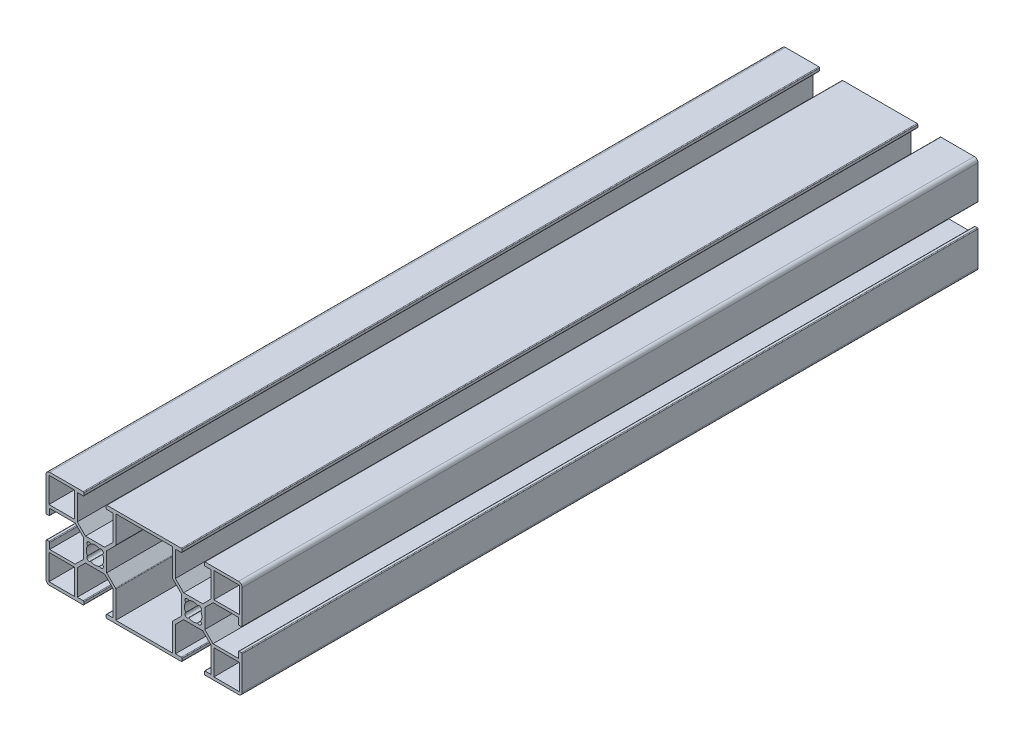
SolidWorks part; units mm, degrees
ref_plane "前视基准面" through (0, 0, 0) normal (0, 0, 1) x (1, 0, 0)
ref_plane "上视基准面" through (0, 0, 0) normal (0, 1, 0) x (1, 0, 0)
ref_plane "右视基准面" through (0, 0, 0) normal (1, 0, 0) x (0, 0, -1)
sketch "草图1" plane through (0, 0, 0) normal (0, 0, 1) x (1, 0, 0)
  line B0 (-60, 18.8) -> (-59.9697, 18.8)
  line B1 (8.45, -8.45) -> (18.8, -8.45)
  line B2 (18.8, -8.45) -> (18.8, -18.8)
  line B3 (18.8, -18.8) -> (8.45, -18.8)
  line B4 (8.45, -18.8) -> (8.45, -8.45)
  line B5 (18.8, 18.8) -> (18.8, 8.45)
  line B6 (18.8, 8.45) -> (8.45, 8.45)
  line B7 (8.45, 8.45) -> (8.45, 18.8)
  line B8 (8.45, 18.8) -> (18.8, 18.8)
  line B9 (-58.8, -18.8) -> (-48.45, -18.8)
  line B10 (-48.45, -18.8) -> (-48.45, -8.45)
  line B11 (-48.45, -8.45) -> (-58.8, -8.45)
  line B12 (-58.8, -8.45) -> (-58.8, -18.8)
  line B13 (-58.8, 8.45) -> (-58.8, 18.8)
  line B14 (-58.8, 18.8) -> (-48.45, 18.8)
  line B15 (-48.45, 18.8) -> (-48.45, 8.45)
  line B16 (-48.45, 8.45) -> (-58.8, 8.45)
  line B17 (-41.7918, 3.0646) -> (-41.8385, 3.1113)
  line B18 (-43.1113, 1.8385) -> (-43.0646, 1.7918)
  line B19 (-43.0646, -1.7918) -> (-43.1113, -1.8385)
  line B20 (-41.8385, -3.1113) -> (-41.7918, -3.0646)
  line B21 (-38.2082, -3.0646) -> (-38.1615, -3.1113)
  line B22 (-36.8887, -1.8385) -> (-36.9354, -1.7918)
  line B23 (-36.9354, 1.7918) -> (-36.8887, 1.8385)
  line B24 (-38.1615, 3.1113) -> (-38.2082, 3.0646)
  line B25 (19.7, -4.55) -> (18.8, -4.55)
  line B26 (18.5, -4.85) -> (18.5, -7.25)
  line B27 (18.5, -7.25) -> (8.0985, -7.25)
  line B28 (8.0985, -7.25) -> (4.75, -3.9015)
  line B29 (4.75, -3.9015) -> (4.75, 3.9015)
  line B30 (4.75, 3.9015) -> (8.0985, 7.25)
  line B31 (8.0985, 7.25) -> (18.5, 7.25)
  line B32 (18.5, 7.25) -> (18.5, 4.85)
  line B33 (18.8, 4.55) -> (19.7, 4.55)
  line B34 (20, 4.85) -> (20, 18.5)
  line B35 (18.5, 20) -> (4.85, 20)
  line B36 (4.55, 19.7) -> (4.55, 18.8)
  line B37 (4.85, 18.5) -> (7.25, 18.5)
  line B38 (7.25, 18.5) -> (7.25, 8.0985)
  line B39 (7.25, 8.0985) -> (3.9015, 4.75)
  line B40 (3.9015, 4.75) -> (-3.9015, 4.75)
  line B41 (-3.9015, 4.75) -> (-7.25, 8.0985)
  line B42 (-7.25, 8.0985) -> (-7.25, 18.5)
  line B43 (-7.25, 18.5) -> (-4.85, 18.5)
  line B44 (-4.55, 18.8) -> (-4.55, 19.7)
  line B45 (-4.85, 20) -> (-35.15, 20)
  line B46 (-35.45, 19.7) -> (-35.45, 18.8)
  line B47 (-35.15, 18.5) -> (-32.75, 18.5)
  line B48 (-32.75, 18.5) -> (-32.75, 8.0985)
  line B49 (-32.75, 8.0985) -> (-36.0985, 4.75)
  line B50 (-36.0985, 4.75) -> (-43.9015, 4.75)
  line B51 (-43.9015, 4.75) -> (-47.25, 8.0985)
  line B52 (-47.25, 8.0985) -> (-47.25, 18.5)
  line B53 (-47.25, 18.5) -> (-44.85, 18.5)
  line B54 (-44.55, 18.8) -> (-44.55, 19.7)
  line B55 (-44.85, 20) -> (-58.5, 20)
  line B56 (-60, 18.5) -> (-60, 4.85)
  line B57 (-59.7, 4.55) -> (-58.8, 4.55)
  line B58 (-58.5, 4.85) -> (-58.5, 7.25)
  line B59 (-58.5, 7.25) -> (-48.0985, 7.25)
  line B60 (-48.0985, 7.25) -> (-44.75, 3.9015)
  line B61 (-44.75, 3.9015) -> (-44.75, -3.9015)
  line B62 (-44.75, -3.9015) -> (-48.0985, -7.25)
  line B63 (-48.0985, -7.25) -> (-58.5, -7.25)
  line B64 (-58.5, -7.25) -> (-58.5, -4.85)
  line B65 (-58.8, -4.55) -> (-59.7, -4.55)
  line B66 (-60, -4.85) -> (-60, -18.5)
  line B67 (-58.5, -20) -> (-44.85, -20)
  line B68 (-44.55, -19.7) -> (-44.55, -18.8)
  line B69 (-44.85, -18.5) -> (-47.25, -18.5)
  line B70 (-47.25, -18.5) -> (-47.25, -8.0985)
  line B71 (-47.25, -8.0985) -> (-43.9015, -4.75)
  line B72 (-43.9015, -4.75) -> (-36.0985, -4.75)
  line B73 (-36.0985, -4.75) -> (-32.75, -8.0985)
  line B74 (-32.75, -8.0985) -> (-32.75, -18.5)
  line B75 (-32.75, -18.5) -> (-35.15, -18.5)
  line B76 (-35.45, -18.8) -> (-35.45, -19.7)
  line B77 (-35.15, -20) -> (-4.85, -20)
  line B78 (-4.55, -19.7) -> (-4.55, -18.8)
  line B79 (-4.85, -18.5) -> (-7.25, -18.5)
  line B80 (-7.25, -18.5) -> (-7.25, -8.0985)
  line B81 (-7.25, -8.0985) -> (-3.9015, -4.75)
  line B82 (-3.9015, -4.75) -> (3.9015, -4.75)
  line B83 (3.9015, -4.75) -> (7.25, -8.0985)
  line B84 (7.25, -8.0985) -> (7.25, -18.5)
  line B85 (7.25, -18.5) -> (4.85, -18.5)
  line B86 (4.55, -18.8) -> (4.55, -19.7)
  line B87 (4.85, -20) -> (18.5, -20)
  line B88 (20, -18.5) -> (20, -4.85)
  line B89 (-35.25, 3.9015) -> (-35.25, -3.9015)
  line B90 (-35.25, -3.9015) -> (-31.6964, -7.455)
  line B91 (-31.55, -7.8086) -> (-31.55, -18.8)
  line B92 (-31.55, -18.8) -> (-8.45, -18.8)
  line B93 (-8.45, -18.8) -> (-8.45, -7.8086)
  line B94 (-8.3036, -7.455) -> (-4.75, -3.9015)
  line B95 (-4.75, -3.9015) -> (-4.75, 3.9015)
  line B96 (-4.75, 3.9015) -> (-8.3036, 7.455)
  line B97 (-8.45, 7.8086) -> (-8.45, 18.8)
  line B98 (-8.45, 18.8) -> (-31.55, 18.8)
  line B99 (-31.55, 18.8) -> (-31.55, 7.8086)
  line B100 (-31.6964, 7.455) -> (-35.25, 3.9015)
  line B101 (-3.1113, 1.8385) -> (-3.0646, 1.7918)
  line B102 (-3.0646, -1.7918) -> (-3.1113, -1.8385)
  line B103 (-1.8385, -3.1113) -> (-1.7918, -3.0646)
  line B104 (1.7918, -3.0646) -> (1.8385, -3.1113)
  line B105 (3.1113, -1.8385) -> (3.0646, -1.7918)
  line B106 (3.0646, 1.7918) -> (3.1113, 1.8385)
  line B107 (1.8385, 3.1113) -> (1.7918, 3.0646)
  line B108 (-1.7918, 3.0646) -> (-1.8385, 3.1113)
  arc B109 (-41.8385, 3.1113) -> (-43.1113, 1.8385) centre (-42.4749, 2.4749) ccw
  arc B110 (-43.0646, 1.7918) -> (-43.0646, -1.7918) centre (-40, 0) ccw
  arc B111 (-43.1113, -1.8385) -> (-41.8385, -3.1113) centre (-42.4749, -2.4749) ccw
  arc B112 (-41.7918, -3.0646) -> (-38.2082, -3.0646) centre (-40, 0) ccw
  arc B113 (-38.1615, -3.1113) -> (-36.8887, -1.8385) centre (-37.5251, -2.4749) ccw
  arc B114 (-36.9354, -1.7918) -> (-36.9354, 1.7918) centre (-40, 0) ccw
  arc B115 (-36.8887, 1.8385) -> (-38.1615, 3.1113) centre (-37.5251, 2.4749) ccw
  arc B116 (-38.2082, 3.0646) -> (-41.7918, 3.0646) centre (-40, 0) ccw
  arc B117 (20, -4.85) -> (19.7, -4.55) centre (19.7, -4.85) ccw
  arc B118 (18.8, -4.55) -> (18.5, -4.85) centre (18.8, -4.85) ccw
  arc B119 (18.5, 4.85) -> (18.8, 4.55) centre (18.8, 4.85) ccw
  arc B120 (19.7, 4.55) -> (20, 4.85) centre (19.7, 4.85) ccw
  arc B121 (20, 18.5) -> (18.5, 20) centre (18.5, 18.5) ccw
  arc B122 (4.85, 20) -> (4.55, 19.7) centre (4.85, 19.7) ccw
  arc B123 (4.55, 18.8) -> (4.85, 18.5) centre (4.85, 18.8) ccw
  arc B124 (-4.85, 18.5) -> (-4.55, 18.8) centre (-4.85, 18.8) ccw
  arc B125 (-4.55, 19.7) -> (-4.85, 20) centre (-4.85, 19.7) ccw
  arc B126 (-35.15, 20) -> (-35.45, 19.7) centre (-35.15, 19.7) ccw
  arc B127 (-35.45, 18.8) -> (-35.15, 18.5) centre (-35.15, 18.8) ccw
  arc B128 (-44.85, 18.5) -> (-44.55, 18.8) centre (-44.85, 18.8) ccw
  arc B129 (-44.55, 19.7) -> (-44.85, 20) centre (-44.85, 19.7) ccw
  arc B130 (-58.5, 20) -> (-60, 18.5) centre (-58.5, 18.5) ccw
  arc B131 (-60, 4.85) -> (-59.7, 4.55) centre (-59.7, 4.85) ccw
  arc B132 (-58.8, 4.55) -> (-58.5, 4.85) centre (-58.8, 4.85) ccw
  arc B133 (-58.5, -4.85) -> (-58.8, -4.55) centre (-58.8, -4.85) ccw
  arc B134 (-59.7, -4.55) -> (-60, -4.85) centre (-59.7, -4.85) ccw
  arc B135 (-60, -18.5) -> (-58.5, -20) centre (-58.5, -18.5) ccw
  arc B136 (-44.85, -20) -> (-44.55, -19.7) centre (-44.85, -19.7) ccw
  arc B137 (-44.55, -18.8) -> (-44.85, -18.5) centre (-44.85, -18.8) ccw
  arc B138 (-35.15, -18.5) -> (-35.45, -18.8) centre (-35.15, -18.8) ccw
  arc B139 (-35.45, -19.7) -> (-35.15, -20) centre (-35.15, -19.7) ccw
  arc B140 (-4.85, -20) -> (-4.55, -19.7) centre (-4.85, -19.7) ccw
  arc B141 (-4.55, -18.8) -> (-4.85, -18.5) centre (-4.85, -18.8) ccw
  arc B142 (4.85, -18.5) -> (4.55, -18.8) centre (4.85, -18.8) ccw
  arc B143 (4.55, -19.7) -> (4.85, -20) centre (4.85, -19.7) ccw
  arc B144 (18.5, -20) -> (20, -18.5) centre (18.5, -18.5) ccw
  arc B145 (-31.55, -7.8086) -> (-31.6964, -7.455) centre (-32.05, -7.8086) ccw
  arc B146 (-8.3036, -7.455) -> (-8.45, -7.8086) centre (-7.95, -7.8086) ccw
  arc B147 (-8.45, 7.8086) -> (-8.3036, 7.455) centre (-7.95, 7.8086) ccw
  arc B148 (-31.6964, 7.455) -> (-31.55, 7.8086) centre (-32.05, 7.8086) ccw
  arc B149 (-1.8385, 3.1113) -> (-3.1113, 1.8385) centre (-2.4749, 2.4749) ccw
  arc B150 (-3.0646, 1.7918) -> (-3.0646, -1.7918) centre (0, 0) ccw
  arc B151 (-3.1113, -1.8385) -> (-1.8385, -3.1113) centre (-2.4749, -2.4749) ccw
  arc B152 (-1.7918, -3.0646) -> (1.7918, -3.0646) centre (0, 0) ccw
  arc B153 (1.8385, -3.1113) -> (3.1113, -1.8385) centre (2.4749, -2.4749) ccw
  arc B154 (3.0646, -1.7918) -> (3.0646, 1.7918) centre (0, 0) ccw
  arc B155 (3.1113, 1.8385) -> (1.8385, 3.1113) centre (2.4749, 2.4749) ccw
  arc B156 (1.7918, 3.0646) -> (-1.7918, 3.0646) centre (0, 0) ccw
sketch_block_instance "块1-1"
sketch_block "块1"
extrude "凸台-拉伸1" add sketch "草图1" along normal blind 300 contours B87 B144 B88 B117 B25 B118 B26 B27 B28 B29 B30 B31 B32 B119 B33 B120 B34 B121 B35 B122 B36 B123 B37 B38 B39 B40 B41 B42 B43 B124 B44 B125 B45 B126 B46 B127 B47 B48 B49 B50 B51 B52 B53 B128 B54 B129 B55 B130 B56 B131
